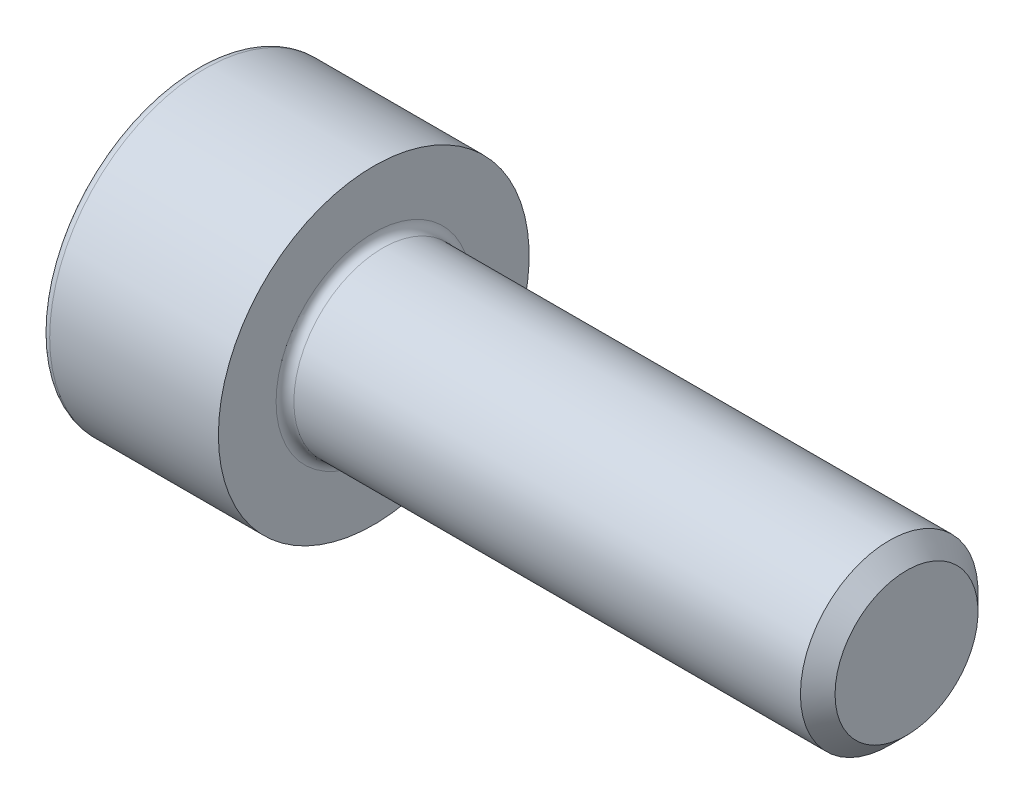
SolidWorks part; units mm, degrees
ref_plane "Plane1" through (0, 0, 0) normal (0, 0, 1) x (1, 0, 0)
ref_plane "Plane2" through (0, 0, 0) normal (0, 1, 0) x (1, 0, 0)
ref_plane "Plane3" through (0, 0, 0) normal (1, 0, 0) x (0, 0, -1)
sketch "BodySke" plane through (0, 0, 0) normal (0, 0, 1) x (1, 0, 0)
  line L0 (0, 0) -> (0, 3.5)
  line L1 (0, 3.5) -> (4, 3.5)
  line L2 (4, 3.5) -> (4, 2)
  line L3 (4, 2) -> (15.61, 2)
  line L4 (16, 1.61) -> (16, 0)
  line L5 (16, 0) -> (0, 0)
  line L6 (-31.75, 0) -> (127, 0) construction
  line L8 (16, 1.61) -> (15.61, 2)
  line L10 (16, -1.61) -> (15.61, -2) construction
  line L11 (4.7, 9.525) -> (4.7, 3.175) construction
  line L12 (6, 9.525) -> (6, 3.175) construction
  line L13 (-44, 9.525) -> (-44, 3.175) construction
  dimension "Diameter" = 4
  dimension "Head_ht" = 4
  dimension "Length" = 12
  dimension "Body_ch_ang" = 45
  dimension "Head_dia" = 7
  dimension "Minor_dia" = 3.22
  dimension "Advance" = 0.7
  dimension "Thread_nom" = 10
  dimension "Thread_length" = 60
revolve "Base-Revolve" add sketch "BodySke"
fillet "Fillet1" radius 0.2 1 edges at (4, 0, 2)
fillet "Fillet2" radius 0.2 1 edges at (0, 0, 3.5)
sketch "Sketch2" plane through (0, 0, 0) normal (0, 0, 1) x (1, 0, 0)
  line L0 (0, 1.5355) -> (2, 1.5355)
  line L1 (2, 1.5355) -> (2.8865, 0)
  line L2 (-31.75, 0) -> (127, 0) construction
  line L3 (2.8865, 0) -> (0, 0)
  line L4 (0, 0) -> (0, 1.5355)
  line L6 (0, 0) -> (47.625, 0) construction
  dimension "D1" = 1.5355
  dimension "D2" = 60
  dimension "Depth" = 2
revolve "Hex-PreBroach" cut sketch "Sketch2" angle 360 about L6
sketch "Sketch3" plane through (0, 0, 0) normal (-1, 0, 0) x (0, 0.5, 0.866)
  line L0 (0.8865, 1.5355) -> (-0.8865, 1.5355)
  line L1 (-0.8865, 1.5355) -> (-1.773, 0)
  line L2 (0.8865, 1.5355) -> (1.773, 0)
  line L3 (0.8865, -1.5355) -> (1.773, 0)
  line L4 (0.8865, -1.5355) -> (-0.8865, -1.5355)
  line L5 (-0.8865, -1.5355) -> (-1.773, 0)
  dimension "D1" = 1.5355
  dimension "D2" = 1.5355
  dimension "Hex_size" = 3.071
extrude "Hex" cut sketch "Sketch3" against normal blind 2
sketch "ThdSchSke" plane through (0, 0, 0) normal (0, 0, 1) x (1, 0, 0)
  line L0 (6.1, -1.61) -> (5.8269, -2)
  line L1 (6.1, -1.61) -> (6.3731, -2)
  line L2 (6.3731, -2) -> (6.3731, -2.5)
  line L3 (-3.175, 0) -> (5.1513, 0) construction
  line L4 (0, 3.3) -> (0, -3.3) construction
  line L5 (6.3731, -2.5) -> (5.8269, -2.5)
  line L6 (5.8269, -2.5) -> (5.8269, -2)
  dimension "Thread_minor" = 3.22
  dimension "Diameter" = 4
  dimension "Start" = 6.1
  dimension "SideAngle" = 55
  dimension "VeeAngle" = 70
  dimension "Overcut" = 5
revolve "ThreadSchematic" [suppressed] cut sketch "ThdSchSke" angle 360 about L3
pattern_linear "ThdSchPat" [suppressed]
equation "\"D2@Sketch3\" = \"Hex_size@Sketch3\" / 2"
equation "\"D1@Sketch3\" = \"Hex_size@Sketch3\" / 2"
equation "\"D1@Sketch2\" = \"Hex_size@Sketch3\" / 2"
equation "\"Thread_minor@ThreadCosmetic\"  =  \"Minor_dia@BodySke\""
equation "\"Depth@Sketch2\" =  \"Key_eng@Hex\""
equation "\"Thread_length@ThreadCosmetic\" = ((sgn( (\"Length@BodySke\" - \"Advance@BodySke\" * 3.0) - \"Thread_nom@BodySke\" )-1)*( (\"Length@BodySke\" - \"Advance@BodySke\" * 3.0) - \"Thread_nom@BodySke\" ))/-2+ \"Thread_no"
equation "\"Thread_minor@ThdSchSke\" = \"Minor_dia@BodySke\""
equation "\"Diameter@ThdSchSke\" = \"Diameter@BodySke\""
equation "\"Overcut@ThdSchSke\" = \"Diameter@BodySke\" * 1.25"
equation "\"Start@ThdSchSke\" = \"Head_ht@BodySke\" + \"Length@BodySke\" - \"Thread_length@ThreadCosmetic\"  '---Non-countersunk---"
equation "\"Num_threads@ThdSchPat\" = int( \"Thread_length@ThreadCosmetic\" / \"Advance@BodySke\" + 0.999 )  + 1"
equation "\"Advance@ThdSchPat\" = \"Thread_length@ThreadCosmetic\" /  (\"Num_threads@ThdSchPat\" - 1) 'relax it"
equation "\"Num_threads@ThdSchPat\" = \"Num_threads@ThdSchPat\" - sgn( \"Num_threads@ThdSchPat\" - 1) '---chamfered tips only---"
